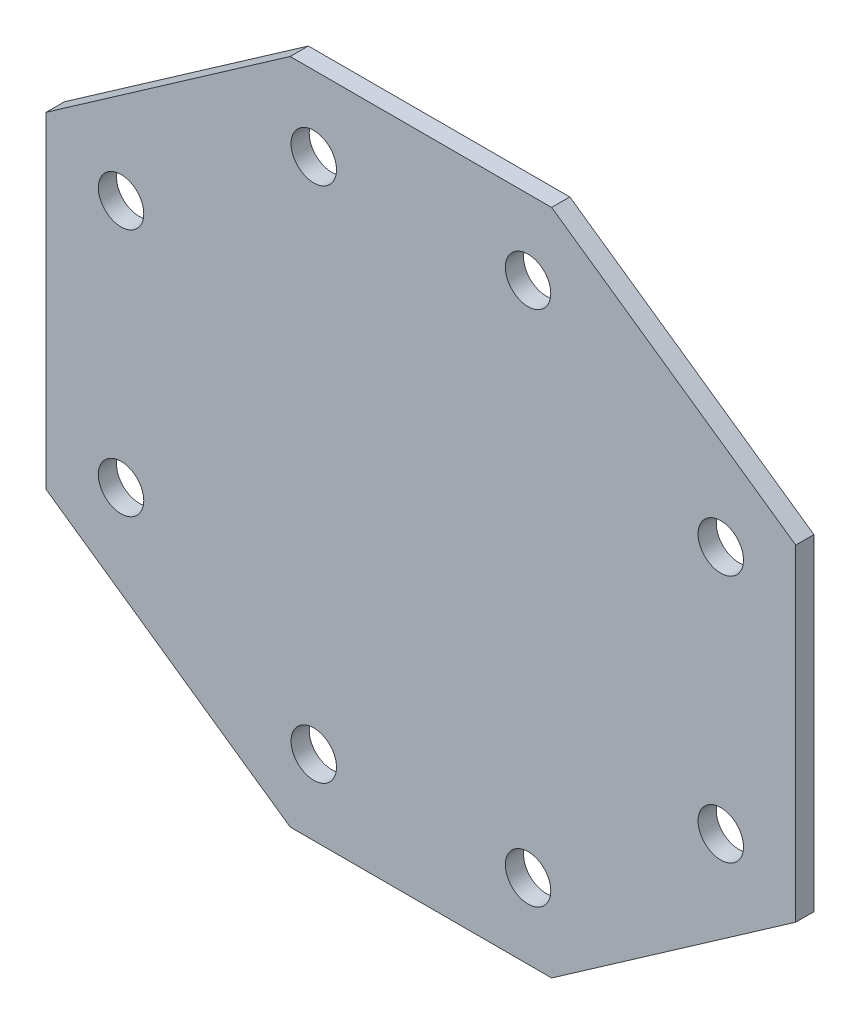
SolidWorks part; units mm, degrees
ref_plane "Front Plane" through (0, 0, 0) normal (1, 0, 0) x (0, 1, 0)
ref_plane "Top Plane" through (0, 0, 0) normal (0, 0, 1) x (0, 1, 0)
ref_plane "Right Plane" through (0, 0, 0) normal (0, 1, 0) x (-1, 0, 0)
sketch "sk W14x730" plane through (0, 0, 0) normal (0, 0, 1) x (0, 1, 0)
  point P0 (0, -284.734)
  point P1 (-38.989, 0)
  line B0 (-227.203, -284.734) -> (-227.203, -160.02)
  line B1 (-227.203, -160.02) -> (-54.229, -160.02)
  line B2 (-38.989, -144.78) -> (-38.989, 144.78)
  line B3 (-54.229, 160.02) -> (-227.203, 160.02)
  line B4 (-227.203, 160.02) -> (-227.203, 284.734)
  line B5 (-227.203, 284.734) -> (227.203, 284.734)
  line B6 (227.203, 284.734) -> (227.203, 160.02)
  line B7 (227.203, 160.02) -> (54.229, 160.02)
  line B8 (38.989, 144.78) -> (38.989, -144.78)
  line B9 (54.229, -160.02) -> (227.203, -160.02)
  line B10 (227.203, -160.02) -> (227.203, -284.734)
  line B11 (227.203, -284.734) -> (-227.203, -284.734)
  arc B12 (-54.229, -160.02) -> (-38.989, -144.78) centre (-54.229, -144.78) ccw
  arc B13 (-38.989, 144.78) -> (-54.229, 160.02) centre (-54.229, 144.78) ccw
  arc B14 (54.229, 160.02) -> (38.989, 144.78) centre (54.229, 144.78) ccw
  arc B15 (38.989, -144.78) -> (54.229, -160.02) centre (54.229, -144.78) ccw
sketch_block_instance "W14x730-113"
sketch_block "W14x730" parameters "D4"=15.24, "D1"=454.406, "D2"=569.468, "D3"=77.978, "D5"=124.714
sketch_block_instance "W14x730-232"
sketch_block_instance "W14x730-233"
sketch_block_instance "W14x730-234"
sketch_block_instance "W14x730-276"
sketch_block_instance "W14x730-277"
sketch_block_instance "W14x730-278"
sketch_block_instance "W14x730-279"
sketch_block_instance "W14x730-280"
sketch_block_instance "W14x730-281"
sketch_block_instance "W14x730-282"
sketch_block_instance "W14x730-283"
sketch_block_instance "W14x730-284"
sketch_block_instance "W14x730-285"
sketch_block_instance "W14x730-286"
sketch_block_instance "W14x730-287"
sketch_block_instance "W14x730-288"
sketch_block_instance "W14x730-289"
sketch_block_instance "W14x730-321"
sketch_block_instance "W14x730-322"
sketch_block_instance "W14x730-323"
sketch_block_instance "W14x730-324"
sketch_block_instance "W14x730-325"
sketch_block_instance "W14x730-326"
sketch_block_instance "W14x730-327"
sketch_block_instance "W14x730-328"
sketch_block_instance "W14x730-329"
sketch_block_instance "W14x730-330"
sketch_block_instance "W14x730-331"
sketch_block_instance "W14x730-332"
sketch_block_instance "W14x730-333"
sketch_block_instance "W14x730-334"
sketch_block_instance "W14x730-335"
sketch_block_instance "W14x730-336"
sketch_block_instance "W14x730-337"
sketch_block_instance "W14x730-338"
sketch_block_instance "W14x730-339"
sketch_block_instance "W14x730-340"
sketch_block_instance "W14x730-341"
sketch_block_instance "W14x730-365"
sketch_block_instance "W14x730-366"
sketch_block_instance "W14x730-367"
sketch_block_instance "W14x730-368"
sketch_block_instance "W14x730-369"
sketch_block_instance "W14x730-370"
sketch_block_instance "W14x730-371"
sketch_block_instance "W14x730-372"
sketch_block_instance "W14x730-373"
sketch_block_instance "W14x730-374"
sketch_block_instance "W14x730-375"
sketch_block_instance "W14x730-376"
sketch_block_instance "W14x730-377"
sketch_block_instance "W14x730-378"
sketch_block_instance "W14x730-379"
sketch_block_instance "W14x730-380"
sketch_block_instance "W14x730-381"
sketch_block_instance "W14x730-382"
sketch_block_instance "W14x730-383"
sketch_block_instance "W14x730-384"
sketch_block_instance "W14x730-385"
sketch_block_instance "W14x730-386"
sketch_block_instance "W14x730-387"
sketch_block_instance "W14x730-388"
sketch_block_instance "W14x730-389"
sketch_block_instance "W14x730-390"
sketch_block_instance "W14x730-391"
sketch_block_instance "W14x730-410"
sketch_block_instance "W14x730-411"
sketch_block_instance "W14x730-412"
sketch_block_instance "W14x730-413"
sketch_block_instance "W14x730-414"
sketch_block_instance "W14x730-415"
sketch_block_instance "W14x730-416"
sketch_block_instance "W14x730-417"
sketch_block_instance "W14x730-418"
sketch_block_instance "W14x730-419"
sketch_block_instance "W14x730-420"
sketch_block_instance "W14x730-421"
sketch_block_instance "W14x730-422"
sketch_block_instance "W14x730-423"
sketch_block_instance "W14x730-424"
sketch_block_instance "W14x730-425"
sketch_block_instance "W14x730-426"
sketch_block_instance "W14x730-427"
sketch_block_instance "W14x730-428"
sketch_block_instance "W14x730-429"
sketch_block_instance "W14x730-430"
sketch_block_instance "W14x730-431"
sketch_block_instance "W14x730-432"
sketch_block_instance "W14x730-433"
sketch_block_instance "W14x730-434"
sketch_block_instance "W14x730-435"
sketch_block_instance "W14x730-436"
sketch_block_instance "W14x730-437"
sketch_block_instance "W14x730-438"
sketch_block_instance "W14x730-439"
sketch_block_instance "W14x730-440"
sketch_block_instance "W14x730-443"
sketch_block_instance "W14x730-454"
sketch_block_instance "W14x730-455"
sketch_block_instance "W14x730-456"
sketch_block_instance "W14x730-457"
sketch_block_instance "W14x730-458"
sketch_block_instance "W14x730-459"
sketch_block_instance "W14x730-460"
sketch_block_instance "W14x730-461"
sketch_block_instance "W14x730-462"
sketch_block_instance "W14x730-463"
sketch_block_instance "W14x730-464"
sketch_block_instance "W14x730-465"
sketch_block_instance "W14x730-466"
sketch_block_instance "W14x730-467"
sketch_block_instance "W14x730-468"
sketch_block_instance "W14x730-469"
sketch_block_instance "W14x730-470"
sketch_block_instance "W14x730-471"
sketch_block_instance "W14x730-472"
sketch_block_instance "W14x730-473"
sketch_block_instance "W14x730-474"
sketch_block_instance "W14x730-475"
sketch_block_instance "W14x730-476"
sketch_block_instance "W14x730-477"
sketch_block_instance "W14x730-478"
sketch_block_instance "W14x730-479"
sketch_block_instance "W14x730-480"
sketch_block_instance "W14x730-481"
sketch_block_instance "W14x730-482"
sketch_block_instance "W14x730-483"
sketch_block_instance "W14x730-484"
sketch_block_instance "W14x730-485"
sketch_block_instance "W14x730-486"
sketch_block_instance "W14x730-487"
sketch_block_instance "W14x730-488"
sketch_block_instance "W14x730-489"
sketch_block_instance "W14x730-490" parameters "D1"=817.9177, "D2"=1027.7361, "D3"=0.4058, "D4"=24.0009, "D5"=0.4058, "D6"=533.4, "D7"=27.3509, "D8"=8374.3758, "D9"=3499.6788, "D10"=18059.4
sketch "sk 4\" hex nut Pattern" plane through (0, 0, 0) normal (0, 0, 1) x (0, 1, 0)
  line L7 (419.0803, -173.5887) -> (419.0803, 173.5887)
  line L8 (419.0803, 173.5887) -> (173.5887, 419.0803)
  line L9 (173.5887, 419.0803) -> (-173.5887, 419.0803)
  line L10 (-173.5887, 419.0803) -> (-419.0803, 173.5887)
  line L11 (-419.0803, 173.5887) -> (-419.0803, -173.5887)
  line L12 (-419.0803, -173.5887) -> (-173.5887, -419.0803)
  line L13 (-173.5887, -419.0803) -> (173.5887, -419.0803)
  line L14 (173.5887, -419.0803) -> (419.0803, -173.5887)
  line L29 (54.229, -125.02) -> (262.203, -125.02)
  line L30 (262.203, -125.02) -> (262.203, -319.734)
  line L31 (-262.203, -125.02) -> (-54.229, -125.02)
  line L32 (-262.203, -319.734) -> (-262.203, -125.02)
  line L33 (262.203, -319.734) -> (-262.203, -319.734)
  line L34 (54.229, -125.02) -> (262.203, -125.02)
  line L35 (262.203, -125.02) -> (262.203, -319.734)
  line L36 (-262.203, -125.02) -> (-54.229, -125.02)
  line L37 (-262.203, -319.734) -> (-262.203, -125.02)
  line L38 (262.203, -319.734) -> (-262.203, -319.734)
  line L39 (-419.0803, 173.5887) -> (419.0803, -173.5887)
  line L40 (419.0803, 173.5887) -> (-419.0803, -173.5887)
  line L42 (-466.3243, 523.8553) -> (466.3243, 523.8553)
  line L43 (-466.3243, 523.8553) -> (-466.3243, -523.8553)
  line L44 (262.203, 125.02) -> (54.229, 125.02)
  line L45 (262.203, 319.734) -> (262.203, 125.02)
  line L46 (-262.203, 319.734) -> (262.203, 319.734)
  line L47 (-262.203, 125.02) -> (-262.203, 319.734)
  line L48 (-54.229, 125.02) -> (-262.203, 125.02)
  line L49 (262.203, 125.02) -> (54.229, 125.02)
  line L50 (262.203, 319.734) -> (262.203, 125.02)
  line L51 (-262.203, 319.734) -> (262.203, 319.734)
  line L52 (-262.203, 125.02) -> (-262.203, 319.734)
  line L53 (-54.229, 125.02) -> (-262.203, 125.02)
  line L54 (-466.3243, -523.8553) -> (466.3243, -523.8553)
  line L55 (466.3243, 523.8553) -> (466.3243, -523.8553)
  circle A0 centre (0, 0) radius 419.0803 construction
  line B0 (-128.6781, -496.8678) -> (-83.7675, -419.0803)
  circle B1 centre (-173.5887, -419.0803) radius 77.7875 construction
  circle B2 centre (-173.5887, -419.0803) radius 50.8
  circle B3 centre (-173.5887, -419.0803) radius 89.8213
  circle B4 centre (-173.5887, -419.0803) radius 99.3463
  line B5 (-83.7675, 419.0803) -> (-128.6781, 496.8678)
  line B6 (-128.6781, 496.8678) -> (-218.4994, 496.8678)
  line B7 (-218.4994, 496.8678) -> (-263.41, 419.0803)
  line B8 (-263.41, 419.0803) -> (-218.4994, 341.2928)
  line B9 (-218.4994, 341.2928) -> (-128.6781, 341.2928)
  circle B10 centre (-173.5887, 419.0803) radius 77.7875 construction
  circle B11 centre (-173.5887, 419.0803) radius 50.8
  circle B12 centre (-173.5887, 419.0803) radius 89.8213
  circle B13 centre (-173.5887, 419.0803) radius 99.3463
  line B14 (263.41, 419.0803) -> (218.4994, 496.8678)
  line B15 (218.4994, 496.8678) -> (128.6781, 496.8678)
  line B16 (128.6781, 496.8678) -> (83.7675, 419.0803)
  line B17 (128.6781, 341.2928) -> (218.4994, 341.2928)
  line B18 (218.4994, 341.2928) -> (263.41, 419.0803)
  circle B19 centre (173.5887, 419.0803) radius 50.8
  circle B20 centre (173.5887, 419.0803) radius 89.8213
  circle B21 centre (173.5887, 419.0803) radius 99.3463
  line B22 (263.41, -419.0803) -> (218.4994, -341.2928)
  line B23 (218.4994, -341.2928) -> (128.6781, -341.2928)
  line B24 (83.7675, -419.0803) -> (128.6781, -496.8678)
  line B25 (128.6781, -496.8678) -> (218.4994, -496.8678)
  line B26 (218.4994, -496.8678) -> (263.41, -419.0803)
  circle B27 centre (173.5887, -419.0803) radius 77.7875 construction
  circle B28 centre (173.5887, -419.0803) radius 50.8
  circle B29 centre (173.5887, -419.0803) radius 89.8213
  circle B30 centre (173.5887, -419.0803) radius 99.3463
  line B31 (-271.728, 149.7586) -> (-316.6386, 227.5461)
  line B32 (-316.6386, 227.5461) -> (-406.4599, 227.5461)
  line B33 (-406.4599, 227.5461) -> (-451.3705, 149.7586)
  line B34 (-451.3705, 149.7586) -> (-406.4599, 71.9711)
  line B35 (-406.4599, 71.9711) -> (-316.6386, 71.9711)
  circle B36 centre (-361.5493, 149.7586) radius 77.7875 construction
  circle B37 centre (-361.5493, 149.7586) radius 50.8
  circle B38 centre (-361.5493, 149.7586) radius 89.8213
  circle B39 centre (-361.5493, 149.7586) radius 99.3463
  line B40 (-271.728, -149.7586) -> (-316.6386, -71.9711)
  line B41 (-316.6386, -71.9711) -> (-406.4599, -71.9711)
  line B42 (-406.4599, -71.9711) -> (-451.3705, -149.7586)
  line B43 (-451.3705, -149.7586) -> (-406.4599, -227.5461)
  line B44 (-406.4599, -227.5461) -> (-316.6386, -227.5461)
  line B45 (-316.6386, -227.5461) -> (-271.728, -149.7586)
  circle B46 centre (-361.5493, -149.7586) radius 77.7875 construction
  circle B47 centre (-361.5493, -149.7586) radius 50.8
  circle B48 centre (-361.5493, -149.7586) radius 89.8213
  circle B49 centre (-361.5493, -149.7586) radius 99.3463
  line B50 (451.3705, 149.7586) -> (406.4599, 227.5461)
  line B51 (406.4599, 227.5461) -> (316.6386, 227.5461)
  line B52 (316.6386, 227.5461) -> (271.728, 149.7586)
  line B53 (316.6386, 71.9711) -> (406.4599, 71.9711)
  circle B54 centre (361.5493, 149.7586) radius 77.7875 construction
  circle B55 centre (361.5493, 149.7586) radius 50.8
  circle B56 centre (361.5493, 149.7586) radius 89.8213
  circle B57 centre (361.5493, 149.7586) radius 99.3463
  line B58 (316.6386, -71.9711) -> (271.728, -149.7586)
  line B59 (406.4599, -227.5461) -> (451.3705, -149.7586)
  circle B60 centre (361.5493, -149.7586) radius 77.7875 construction
  circle B61 centre (361.5493, -149.7586) radius 50.8
  circle B62 centre (361.5493, -149.7586) radius 89.8213
  circle B63 centre (361.5493, -149.7586) radius 99.3463
sketch_block_instance "4\" hex nut-1"
sketch_block "4\" hex nut" parameters "D1"=155.575, "D2"=101.6, "D3"=9.525
sketch_block_instance "4\" hex nut-2"
sketch_block_instance "4\" hex nut-3"
sketch_block_instance "4\" hex nut-4"
sketch_block_instance "4\" hex nut-5"
sketch_block_instance "4\" hex nut-6"
sketch_block_instance "4\" hex nut-7"
sketch_block_instance "4\" hex nut-8" parameters "D1"=129.9071, "D2"=77.383, "D3"=138.8929, "D4"=187.7059, "D5"=195.0068, "D6"=231.3326
sketch "Sketch3" plane through (0, 0, 0) normal (0, 0, 1) x (0, 1, 0)
  line L0 (-466.3243, 523.8553) -> (466.3243, 523.8553) construction
  line L1 (466.3243, 523.8553) -> (466.3243, -523.8553) construction
  line L2 (-466.3243, -523.8553) -> (466.3243, -523.8553) construction
  line L3 (-466.3243, 523.8553) -> (-466.3243, -523.8553) construction
  line L4 (228.2342, 523.8553) -> (466.3243, 182.7049)
  line L5 (466.3243, 182.7049) -> (466.3243, -182.7049)
  line L6 (466.3243, -182.7049) -> (228.2342, -523.8553)
  line L7 (228.2342, -523.8553) -> (-228.2342, -523.8553)
  line L8 (-228.2342, -523.8553) -> (-466.3243, -182.7049)
  line L9 (-466.3243, -182.7049) -> (-466.3243, 182.7049)
  line L10 (-466.3243, 182.7049) -> (-228.2342, 523.8553)
  line L11 (-228.2342, 523.8553) -> (228.2342, 523.8553)
  line L93 (-54.229, 156.845) -> (-230.378, 156.845)
  line L94 (-230.378, 156.845) -> (-230.378, 287.909)
  line L95 (230.378, 156.845) -> (54.229, 156.845)
  line L96 (230.378, 287.909) -> (230.378, 156.845)
  line L97 (-230.378, 287.909) -> (230.378, 287.909)
  line L98 (-54.229, 156.845) -> (-230.378, 156.845) construction
  line L99 (-230.378, 156.845) -> (-230.378, 287.909) construction
  line L100 (230.378, 156.845) -> (54.229, 156.845) construction
  line L101 (230.378, 287.909) -> (230.378, 156.845) construction
  line L102 (-230.378, 287.909) -> (230.378, 287.909) construction
  line L118 (54.229, -156.845) -> (230.378, -156.845)
  line L119 (230.378, -156.845) -> (230.378, -287.909)
  line L120 (230.378, -287.909) -> (-230.378, -287.909)
  line L121 (-230.378, -287.909) -> (-230.378, -156.845)
  line L122 (-230.378, -156.845) -> (-54.229, -156.845)
  line L123 (54.229, -156.845) -> (230.378, -156.845) construction
  line L124 (230.378, -156.845) -> (230.378, -287.909) construction
  line L125 (230.378, -287.909) -> (-230.378, -287.909) construction
  line L126 (-230.378, -287.909) -> (-230.378, -156.845) construction
  line L127 (-230.378, -156.845) -> (-54.229, -156.845) construction
  line L130 (42.164, 144.78) -> (42.164, -144.78)
  line L131 (42.164, 144.78) -> (42.164, -144.78) construction
  line L132 (-54.229, 156.845) -> (-42.164, 144.78) construction
  line L133 (-42.164, -144.78) -> (-42.164, 144.78)
  line L134 (-42.164, -144.78) -> (-42.164, 144.78) construction
  line L135 (42.164, 144.78) -> (54.229, 156.845) construction
  line L136 (42.164, -144.78) -> (54.229, -156.845) construction
  line L137 (-54.229, -156.845) -> (-42.164, -144.78) construction
  circle A0 centre (173.5887, 419.0803) radius 104.775 construction
  circle A1 centre (-173.5887, 419.0803) radius 104.775 construction
  circle A2 centre (-361.5493, 149.7586) radius 104.775 construction
  circle A3 centre (-361.5493, -149.7586) radius 104.775 construction
  circle A4 centre (-173.5887, -419.0803) radius 104.775 construction
  circle A5 centre (173.5887, -419.0803) radius 104.775 construction
  circle A6 centre (361.5493, -149.7586) radius 104.775 construction
  circle A7 centre (361.5493, 149.7586) radius 104.775 construction
  dimension "D1" = 3.175
  dimension "D2" = 3.175
  dimension "D3" = 3.175
  dimension "D4" = 3.175
extrude "Main Plate" add sketch "Sketch3" along normal blind 25.4
sketch "Sketch5" plane through (0, 0, 0) normal (0, 0, 1) x (0, 1, 0)
  circle A0 centre (-173.5887, 419.0803) radius 31.75
  circle A1 centre (173.5887, 419.0803) radius 31.75
  circle A2 centre (361.5493, 149.7586) radius 31.75
  circle A3 centre (361.5493, -149.7586) radius 31.75
  circle A4 centre (173.5887, -419.0803) radius 31.75
  circle A5 centre (-173.5887, -419.0803) radius 31.75
  circle A6 centre (-361.5493, -149.7586) radius 31.75
  circle A7 centre (-361.5493, 149.7586) radius 31.75
  dimension "D1" = 63.5
  dimension "D2" = 63.5
  dimension "D3" = 63.5
  dimension "D4" = 63.5
  dimension "D5" = 63.5
  dimension "D6" = 63.5
  dimension "D7" = 63.5
  dimension "D8" = 63.5
extrude "Cut-Extrude1" cut sketch "Sketch5" against normal through all both and the other way through all
